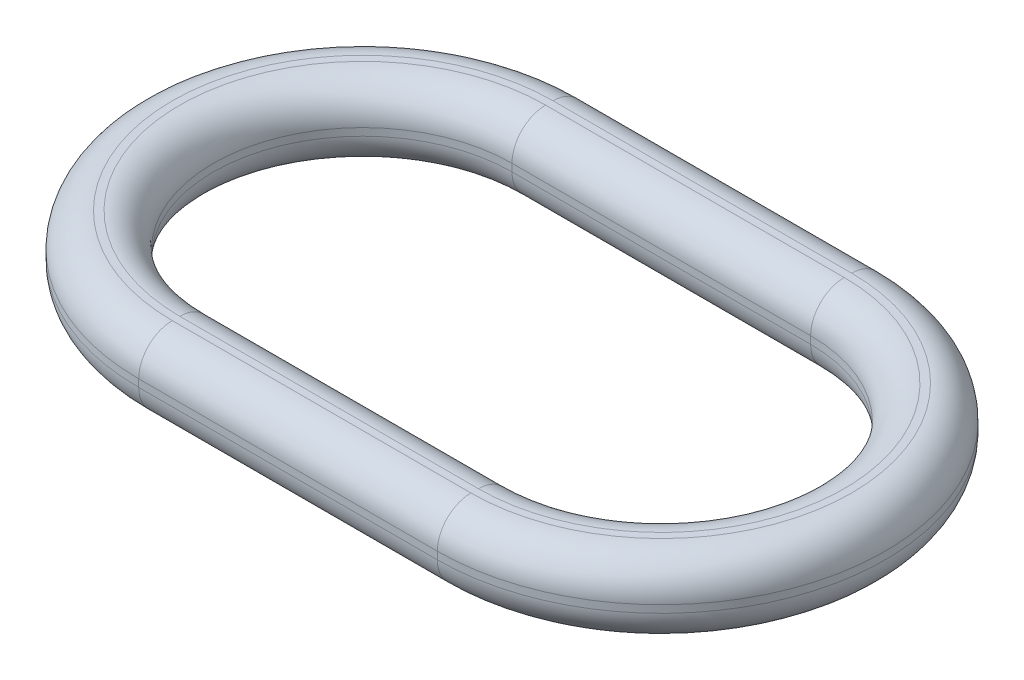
SolidWorks part; units mm, degrees
ref_plane "Front Plane" through (0, 0, 0) normal (0, 0, 1) x (1, 0, 0)
ref_plane "Top Plane" through (0, 0, 0) normal (0, 1, 0) x (1, 0, 0)
ref_plane "Right Plane" through (0, 0, 0) normal (1, 0, 0) x (0, 0, -1)
sketch "Sketch1" plane through (0, 0, 0) normal (0, 1, 0) x (1, 0, 0)
  circle A0 centre (0, 0) radius 3
  circle A1 centre (0, 0) radius 4
  dimension "D1" = 8
  dimension "D2" = 6
extrude "Boss-Extrude1" [suppressed] add sketch "Sketch1" along normal blind 1
fillet "Fillet1" [suppressed] radius 0.475
sketch "Sketch2" plane through (0, 0, 0) normal (0, 1, 0) x (1, 0, 0)
  line L0 (0, 0) -> (4, 0) construction
  line L1 (-0.6985, 0) -> (0.6985, 0) construction
  line L2 (0, 2) -> (4, 2)
  line L3 (0, -2) -> (4, -2)
  line L4 (0, 0) -> (4, 0) construction
  line L5 (0, 3) -> (4, 3)
  line L6 (0, -3) -> (4, -3)
  arc A0 (0, 2) -> (0, -2) centre (0, 0) ccw
  arc A1 (4, -2) -> (4, 2) centre (4, 0) ccw
  arc A2 (0, 3) -> (0, -3) centre (0, 0) ccw
  arc A3 (4, -3) -> (4, 3) centre (4, 0) ccw
  point P4 (2, 0)
  point P9 (2, 0)
  dimension "D1" = 1
  dimension "D2" = 4
  dimension "D3" = 4
extrude "Boss-Extrude2" add sketch "Sketch2" along normal blind 1
fillet "Fillet2" radius 0.45 16 edges at (-2, 0, 0) (2, 0, -2) (6, 0, 0) (-3, 0, 0) (2, 0, -3) (7, 0, 0) (-3, 1, 0) (2, 1, -3) (7, 1, 0) (6, 1, 0) (2, 1, 2) (-2, 1, 0) (2, 0, 2) (2, 0, 3) (2, 1, 3) (2, 1, -2)
